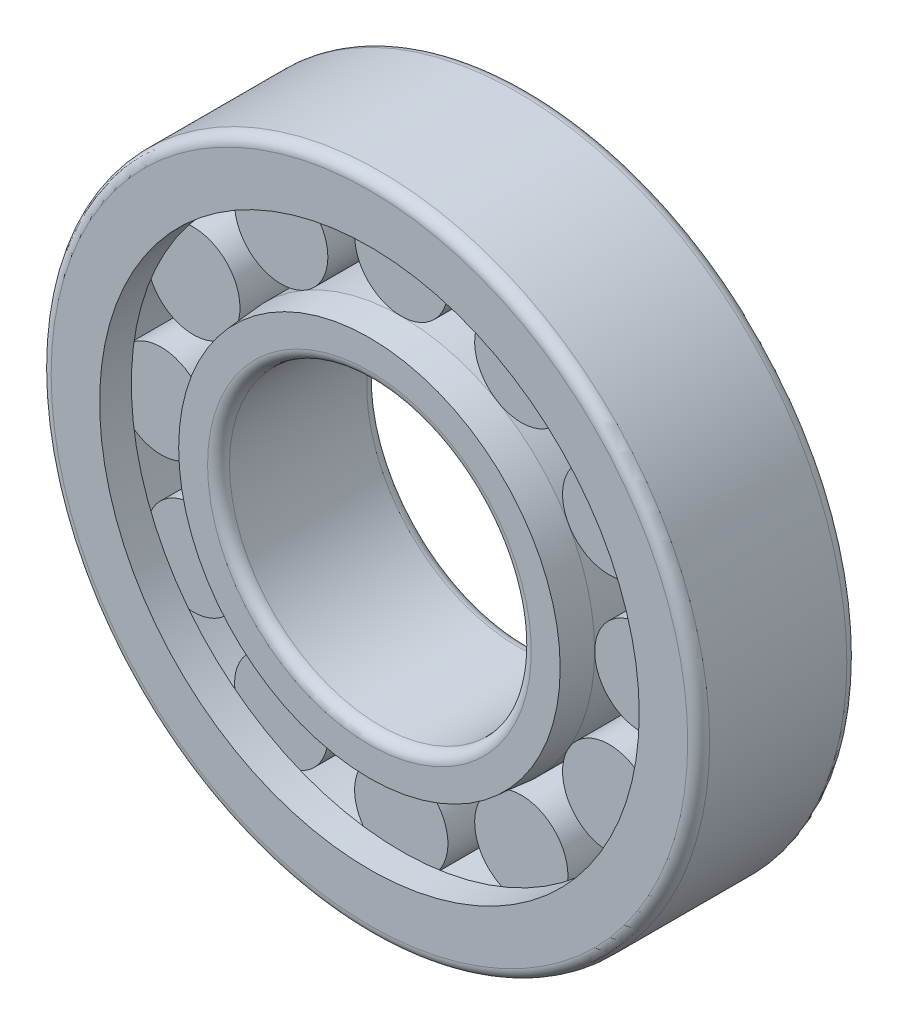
SolidWorks part; units mm, degrees
ref_plane "Front Plane" through (0, 0, 0) normal (0, 0, 1) x (1, 0, 0)
ref_plane "Top Plane" through (0, 0, 0) normal (0, 1, 0) x (1, 0, 0)
ref_plane "Right Plane" through (0, 0, 0) normal (1, 0, 0) x (0, 0, -1)
sketch "BaseSke" plane through (0, 0, 0) normal (1, 0, 0) x (0, 0, -1)
  line L0 (-47.2296, 0) -> (24.6132, 0) construction
  line L1 (-47.2296, 43.75) -> (24.6132, 43.75) construction
  line L2 (0, 129.5214) -> (0, -86.3012) construction
  line L3 (-8.7, 43.75) -> (-8.7, 52.25) construction
  line L4 (-14.5, 60) -> (14.5, 60) construction
  line L5 (-14.5, 27.5) -> (14.5, 27.5) construction
  line L6 (-8.7, 35.25) -> (8.7, 35.25)
  line L7 (-8.7, 35.25) -> (-8.7, 43.75)
  line L8 (-8.7, 43.75) -> (8.7, 43.75)
  line L9 (8.7, 35.25) -> (8.7, 43.75)
  line L10 (-8.7, 52.25) -> (8.7, 52.25) construction
  line L11 (8.7, 52.25) -> (8.7, 43.75) construction
  dimension "D2" = 17.4
  dimension "Bearing_Thickness" = 29
  dimension "Bearing_Outside_Diameter" = 120
  dimension "Bearing_Inside_Diameter" = 55
  dimension "Diameter_Fw" = 70.5
  dimension "Diameter_Ew" = 104.5
revolve "Roller" add sketch "BaseSke" angle 360 about L8
sketch "OuterRaceSke" plane through (0, 0, 0) normal (1, 0, 0) x (0, 0, -1)
  line L0 (0, 0) -> (0, 87.5396) construction
  line L1 (-14.5, 60) -> (14.5, 60)
  line L2 (-14.5, 60) -> (-14.5, 49.1667)
  line L3 (-14.5, 49.1667) -> (-8.725, 49.1667)
  line L4 (14.5, 60) -> (14.5, 49.1667)
  line L5 (-50.3916, 0) -> (55.2197, 0) construction
  line L6 (-8.7, 52.25) -> (8.7, 52.25) construction
  line L7 (8.725, 49.1667) -> (14.5, 49.1667)
  line L9 (-8.725, 49.1667) -> (-8.725, 52.23)
  line L10 (-8.725, 52.23) -> (8.725, 52.23)
  line L11 (8.725, 49.1667) -> (8.725, 52.23)
  dimension "D1" = 17.45
  dimension "D2" = 98.3333
  dimension "D3" = 0.02
revolve "OuterRace" add sketch "OuterRaceSke" angle 360 about L5
sketch "InnerRaceSke" plane through (0, 0, 0) normal (1, 0, 0) x (0, 0, -1)
  line L0 (-70.8626, 0) -> (113.5527, 0) construction
  line L1 (0, 58.441) -> (0, -70.8113) construction
  line L2 (-14.5, 27.5) -> (14.5, 27.5)
  line L3 (-14.5, 27.5) -> (-14.5, 38.3333)
  line L4 (-8.725, 38.3333) -> (-8.725, 35.27)
  line L5 (-8.725, 38.3333) -> (-14.5, 38.3333)
  line L6 (0, 129.5214) -> (0, -86.3012) construction
  line L7 (-8.725, 35.27) -> (8.725, 35.27)
  line L9 (14.5, 27.5) -> (14.5, 38.3333)
  line L10 (8.725, 38.3333) -> (14.5, 38.3333)
  line L11 (8.725, 35.27) -> (8.725, 38.3333)
  line L13 (-8.7, 35.25) -> (8.7, 35.25) construction
  point P17 (0, 27.5)
  dimension "D2" = 0.02
  dimension "D1" = 17.45
  dimension "D3" = 76.6667
revolve "InnerRace" add sketch "InnerRaceSke" angle 360 about L0
fillet "Fillet1" radius 2 4 edges at (27.5, 0, 14.5) (60, 0, -14.5) (60, 0, 14.5) (27.5, 0, -14.5)
sketch "CutGrooveSke" plane through (0, 0, 0) normal (1, 0, 0) x (0, 0, -1)
  line L0 (-51.8407, 0) -> (83.8302, 0) construction
  line L1 (-7.25, -78.8) -> (-8.7, -78.8)
  line L2 (-7.25, -78.8) -> (-7.25, -58.8)
  line L3 (-7.25, -58.8) -> (-8.7, -58.8)
  line L4 (-8.7, -78.8) -> (-8.7, -58.8)
  dimension "D1" = 58.8
  dimension "D2" = 7.25
  dimension "D3" = 1.45
  dimension "D4" = 20
revolve "CutGroove" [suppressed] cut sketch "CutGrooveSke" angle 360 about L0
sketch "TaperSke" plane through (0, 0, 0) normal (1, 0, 0) x (0, 0, -1)
  line L0 (-14.5, 27.5) -> (14.5, 27.5)
  line L1 (14.5, 27.5) -> (14.5, 29.9167)
  line L2 (14.5, 29.9167) -> (-14.5, 27.5)
  line L7 (-41.2502, 0) -> (40.8606, 0) construction
  dimension "Taper" = 2.4167
revolve "Taper" [suppressed] cut sketch "TaperSke" angle 360 about L7
fillet "Fillet2" [suppressed] radius 2
sketch "NFSke" plane through (0, 0, 0) normal (1, 0, 0) x (0, 0, -1)
  line L0 (-54.6114, 0) -> (63.7655, 0) construction
  line L1 (14.5, 52.7352) -> (8.725, 52.23)
  line L2 (8.725, 52.23) -> (8.725, 49.1667)
  line L3 (8.725, 49.1667) -> (14.5, 49.1667)
  line L4 (14.5, 49.1667) -> (14.5, 52.7352)
  dimension "D1" = 5
revolve "NF" [suppressed] cut sketch "NFSke" angle 360 about L0
mirror "N" [suppressed] about plane through (0, 0, 0) normal (0, 0, 1)
sketch "NJSke" plane through (0, 0, 0) normal (1, 0, 0) x (0, 0, -1)
  line L0 (-35.6078, 0) -> (44.429, 0) construction
  line L1 (14.5, 38.3333) -> (8.725, 38.3333)
  line L2 (8.725, 38.3333) -> (8.725, 35.27)
  line L3 (8.725, 35.27) -> (14.5, 34.7648)
  line L4 (14.5, 34.7648) -> (14.5, 38.3333)
  dimension "D1" = 5
revolve "NJ" cut sketch "NJSke" angle 360 about L0
mirror "NU" about plane through (0, 0, 0) normal (0, 0, 1) of "NJ"
pattern_circular "CirPatternBall" count 12 over 360 about axis through (0, 0, 0) along (0, 0, 1) of "Roller"
sketch "SimplifiedSke" plane through (0, 0, 0) normal (1, 0, 0) x (0, 0, -1)
  line L0 (37.5911, 0) -> (-37.5911, 0) construction
  line L1 (-13.1351, 43.75) -> (13.151, 43.75) construction
  line L2 (-8.7, 52.25) -> (8.7, 52.25)
  line L3 (-8.7, 52.25) -> (-8.7, 35.25)
  line L4 (-8.7, 35.25) -> (8.7, 35.25)
  line L5 (8.7, 52.25) -> (8.7, 35.25)
  line L6 (-47.2296, 43.75) -> (24.6132, 43.75) construction
revolve "Simplified" [suppressed] add sketch "SimplifiedSke" angle 360 about L0
equation "\"D2@BaseSke\" = \"Bearing_Thickness@BaseSke\"*0.6"
equation "\"D1@OuterRaceSke\" = \"Bearing_Thickness@BaseSke\"*0.6+0.05"
equation "\"D2@OuterRaceSke\" =\"Bearing_Outside_Diameter@BaseSke\" -  ( \"Bearing_Outside_Diameter@BaseSke\" - \"Bearing_Inside_Diameter@BaseSke\"  )/ 3 "
equation "\"D1@InnerRaceSke\" = \"Bearing_Thickness@BaseSke\"*0.6+0.05"
equation "\"D3@InnerRaceSke\" = \"Bearing_Inside_Diameter@BaseSke\" +  ( \"Bearing_Outside_Diameter@BaseSke\" - \"Bearing_Inside_Diameter@BaseSke\" ) / 3 "
equation "\"D1@CirPatternBall\" =  int(  ( \"Bearing_Outside_Diameter@BaseSke\" + \"Bearing_Inside_Diameter@BaseSke\" )  / 2 *  pi  /  ( \"Bearing_Outside_Diameter@BaseSke\" - \"Bearing_Inside_Diameter@BaseSke\" ) * 3 ) "
equation "\"D1@CutGrooveSke\" = \"Bearing_Outside_Diameter@BaseSke\" * 0.49"
equation "\"D2@CutGrooveSke\" = \"Bearing_Thickness@BaseSke\" *0.25"
equation "\"D3@CutGrooveSke\" = \"Bearing_Thickness@BaseSke\"/20"
equation "\"Taper@TaperSke\" = \"Bearing_Thickness@BaseSke\"/12"
equation "\"D1@Fillet2\" = \"Fillet_radius@Fillet1\""
